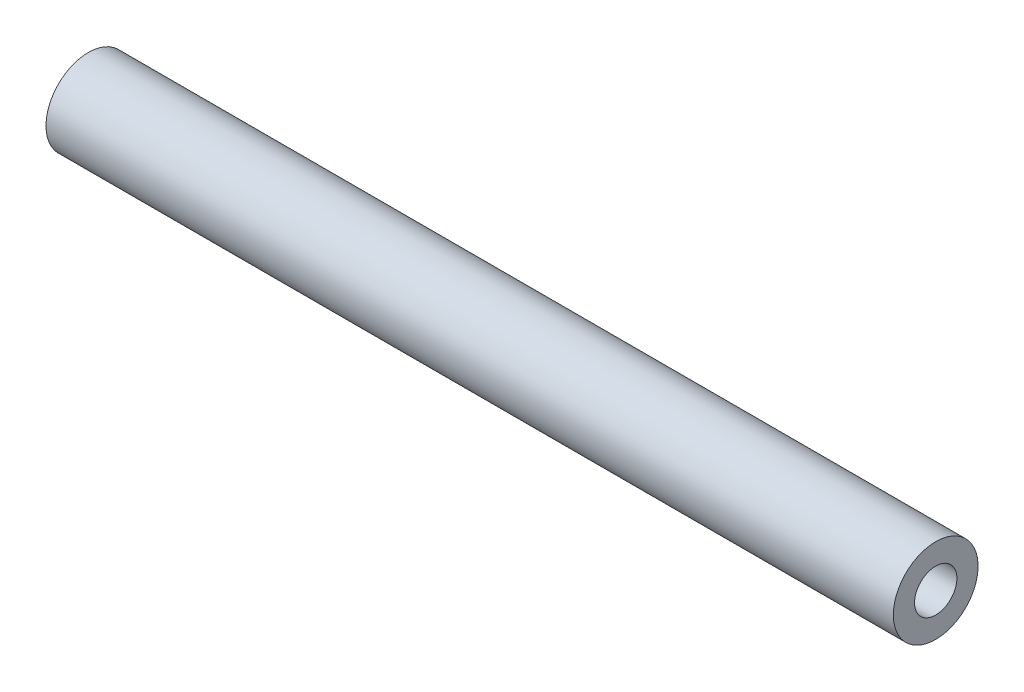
SolidWorks part; units mm, degrees
ref_plane "Ebene1" through (0, 0, 0) normal (0, 0, 1) x (1, 0, 0)
ref_plane "Ebene2" through (0, 0, 0) normal (0, 1, 0) x (1, 0, 0)
ref_plane "Ebene3" through (0, 0, 0) normal (1, 0, 0) x (0, 0, -1)
sketch "Skizze1" plane through (0, 0, 0) normal (0, 0, 1) x (1, 0, 0)
  line L0 (0, 0) -> (23.0809, 0) construction
  line L1 (0, 0) -> (-100, 0)
  line L2 (0, 0) -> (0, 5)
  line L3 (0, 5) -> (-100, 5)
  line L4 (-100, 0) -> (-100, 5)
  dimension "D1" = 10
  dimension "D2" = 100
revolve "Rotation1" add sketch "Skizze1" angle 360 about L0
hole_wizard "M6 Gewindebohrung1" positions "Skizze3" profile "Skizze2" tap size "M6" standard "DIN"
sketch "Skizze3" plane through (0, 0, 0) normal (1, 0, 0) x (0, 0, -1)
  point P0 (0, 0)
sketch "Skizze2" plane through (0, 0, 0) normal (0, 1, 0) x (0, 0, -1)
  line L0 (0, 0) -> (0, 18.5022)
  line L1 (0, 18.5022) -> (2.5, 17)
  line L2 (2.5, 17) -> (2.5, 0)
  line L5 (2.5, 0) -> (0, 0)
  line L10 (0, 18.5022) -> (-2.5, 17) construction
  line L11 (0, -6.35) -> (0, 107.95) construction
  dimension "Bohrerdurchmesser" = 5
  dimension "Bohrungstiefe" = 17
  dimension "Spitzenwinkel" = 118
